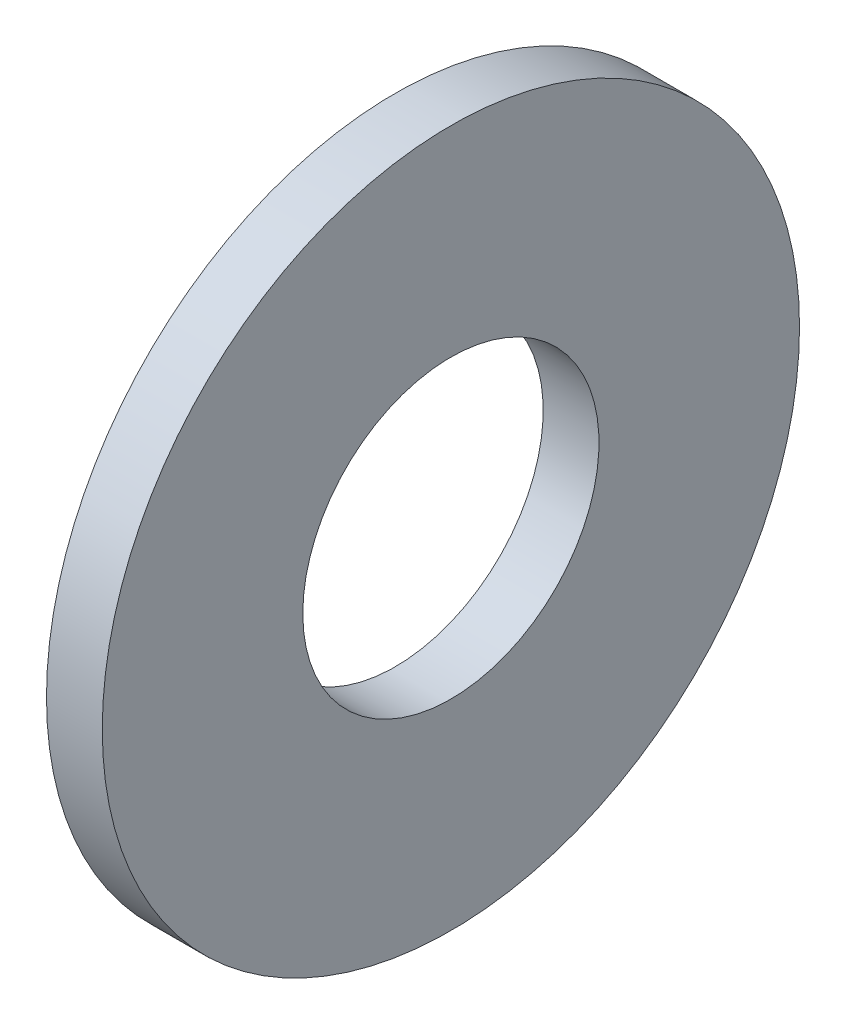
SolidWorks part; units mm, degrees
ref_plane "Plane1" through (0, 0, 0) normal (0, 0, 1) x (1, 0, 0)
ref_plane "Plane2" through (0, 0, 0) normal (0, 1, 0) x (1, 0, 0)
ref_plane "Plane3" through (0, 0, 0) normal (1, 0, 0) x (0, 0, -1)
sketch "Sketch1" plane through (0, 0, 0) normal (0, 0, 1) x (1, 0, 0)
  line L0 (-34.925, 0) -> (9.525, 0) construction
  line L1 (0, 6.7437) -> (0, 15.875)
  line L2 (0, 15.875) -> (-2.54, 15.875)
  line L3 (-2.54, 15.875) -> (-2.54, 6.7437)
  line L4 (-2.54, 6.7437) -> (0, 6.7437)
  dimension "Thickness" = 2.54
  dimension "Inside_dia" = 13.4874
  dimension "Outside_dia" = 31.75
revolve "Base-Revolve" add sketch "Sketch1" angle 360 about L0
